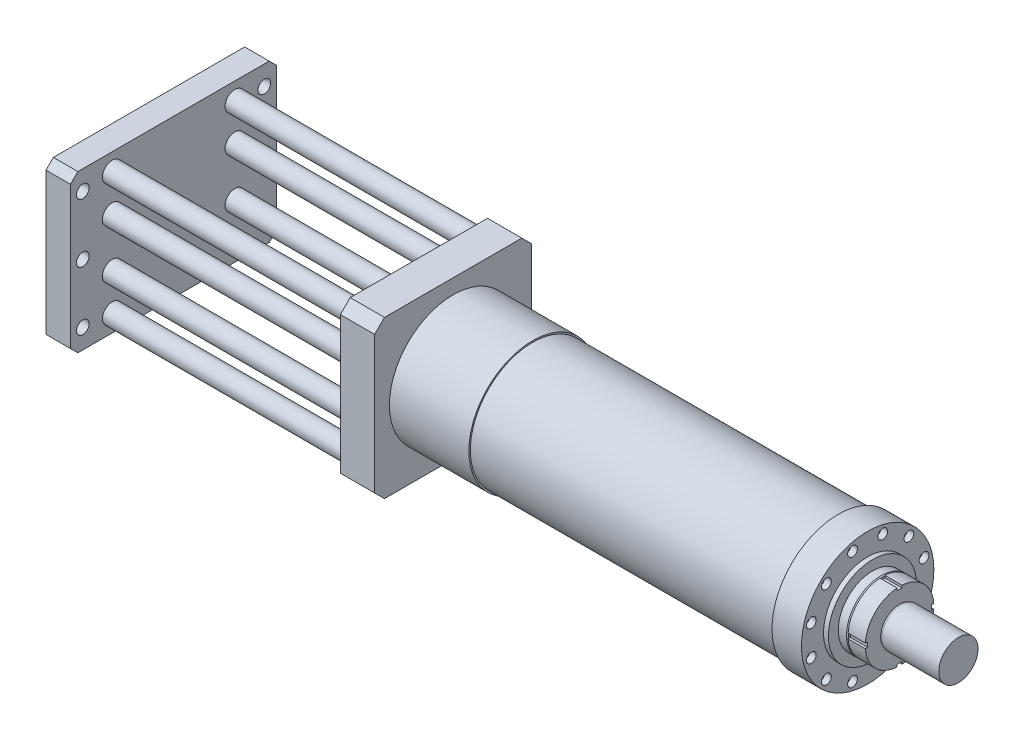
SolidWorks part; units mm, degrees
ref_plane "前视基准面" through (0, 0, 0) normal (0, 0, 1) x (1, 0, 0)
ref_plane "上视基准面" through (0, 0, 0) normal (0, 1, 0) x (1, 0, 0)
ref_plane "右视基准面" through (0, 0, 0) normal (1, 0, 0) x (0, 0, -1)
sketch "草图1" plane through (0, 0, 0) normal (1, 0, 0) x (0, 0, -1)
  circle A0 centre (0, 0) radius 127
  circle A1 centre (0, 0) radius 110
  dimension "D1" = 254
  dimension "D2" = 220
extrude "凸台-拉伸1" add sketch "草图1" along normal blind 623
sketch "草图2" plane through (623, 0, 0) normal (1, 0, 0) x (0, 0, -1)
  line L0 (0, 0) -> (30.7995, 114.9452) construction
  line L2 (0, 0) -> (0, 98.0667) construction
  circle A0 centre (0, 0) radius 135
  circle A1 centre (30.7995, 114.9452) radius 6.5
  circle A2 centre (84.1457, 84.1457) radius 6.5
  circle A3 centre (114.9452, 30.7995) radius 6.5
  circle A4 centre (114.9452, -30.7995) radius 6.5
  circle A5 centre (84.1457, -84.1457) radius 6.5
  circle A6 centre (30.7995, -114.9452) radius 6.5
  circle A7 centre (-30.7995, -114.9452) radius 6.5
  circle A8 centre (-84.1457, -84.1457) radius 6.5
  circle A9 centre (-114.9452, -30.7995) radius 6.5
  circle A10 centre (-114.9452, 30.7995) radius 6.5
  circle A11 centre (-84.1457, 84.1457) radius 6.5
  circle A12 centre (-30.7995, 114.9452) radius 6.5
  point P0 (0, 0)
  point P32 (0, 0)
  dimension "D1" = 270
  dimension "D4" = 12
  dimension "D2" = 119
  dimension "D3" = 15
extrude "凸台-拉伸2" add sketch "草图2" along normal blind 60 separate body
sketch "草图3" plane through (683, 0, 0) normal (1, 0, 0) x (0, 0, -1)
  circle A0 centre (0, 0) radius 90
  dimension "D1" = 180
extrude "凸台-拉伸3" add sketch "草图3" along normal blind 10
sketch "草图5" plane through (693, 0, 0) normal (1, 0, 0) x (0, 0, -1)
  circle A0 centre (0, 0) radius 70
  dimension "D1" = 140
extrude "凸台-拉伸4" add sketch "草图5" along normal blind 20
chamfer "倒角1" distance 3 angle 20 1 edges at (713, 0, -70)
sketch "草图7" plane through (713, 0, 0) normal (1, 0, 0) x (0, 0, -1)
  circle A0 centre (0, 0) radius 70
  dimension "D1" = 140
extrude "凸台-拉伸5" add sketch "草图7" along normal blind 35
sketch "草图8" plane through (748, 0, 0) normal (1, 0, 0) x (0, 0, -1)
  circle A0 centre (0, 0) radius 38.5
  dimension "D1" = 77
extrude "凸台-拉伸6" add sketch "草图8" along normal blind 4
sketch "草图9" plane through (752, 0, 0) normal (1, 0, 0) x (0, 0, -1)
  circle A0 centre (0, 0) radius 40
  dimension "D1" = 80
extrude "凸台-拉伸7" add sketch "草图9" along normal blind 116
sketch "草图10" plane through (748, 0, 0) normal (1, 0, 0) x (0, 0, -1)
  line L0 (-5, -77.2193) -> (-5, -65)
  line L1 (5, -77.2193) -> (5, -65)
  line L2 (-76.4659, 5) -> (-65, 5)
  line L3 (98.9652, -5) -> (65, -5)
  line L4 (-65, 5) -> (-65, -5)
  line L5 (65, 5) -> (65, -5)
  line L6 (-5, 65) -> (5, 65)
  line L7 (-5, -65) -> (5, -65)
  line L8 (-76.4659, 5) -> (-79.4605, -5)
  line L9 (98.9652, 5) -> (98.9652, -5)
  line L10 (-5, 100.6875) -> (5, 100.6875)
  line L11 (-5, -77.2193) -> (5, -77.2193)
  line L12 (5, 65) -> (5, 100.6875)
  line L13 (-5, 65) -> (-5, 100.6875)
  line L15 (-65, -5) -> (-79.4605, -5)
  line L19 (65, 5) -> (98.9652, 5)
  dimension "D1" = 5
  dimension "D2" = 5
  dimension "D3" = 5
  dimension "D4" = 5
  dimension "D5" = 65
  dimension "D6" = 65
  dimension "D7" = 65
  dimension "D8" = 65
extrude "切除-拉伸2" cut sketch "草图10" against normal blind 35 contours L10 L12 L6 L13 | L19 L9 L3 L5 | L0 L7 L1 L11 | L8 L15 L4 L2
sketch "草图11" plane through (0, 0, 0) normal (-1, 0, 0) x (0, 0, 1)
  circle A0 centre (0, 0) radius 130
  dimension "D1" = 260
extrude "凸台-拉伸8" add sketch "草图11" along normal blind 162 separate body
sketch "草图15" plane through (-162, 0, 0) normal (-1, 0, 0) x (0, 0, 1)
  line L5 (-160, 160) -> (160, 160)
  line L6 (-160, 160) -> (-160, -160)
  line L7 (-160, -160) -> (160, -160)
  line L8 (160, 160) -> (160, -160)
  line L9 (-160, 160) -> (160, -160) construction
  line L10 (-160, -160) -> (160, 160) construction
  point P0 (0, 0)
  dimension "D1" = 320
  dimension "D2" = 320
extrude "凸台-拉伸10" add sketch "草图15" along normal blind 70 separate body
sketch "草图16" plane through (-232, 0, 0) normal (-1, 0, 0) x (0, 0, 1)
  circle A0 centre (0, 0) radius 80
  dimension "D1" = 160
extrude "切除-拉伸4" cut sketch "草图16" against normal blind 26
sketch "草图17" plane through (-206, 0, 0) normal (-1, 0, 0) x (0, 0, 1)
  circle A0 centre (0, 0) radius 81.5
  dimension "D1" = 163
extrude "切除-拉伸5" cut sketch "草图17" against normal blind 38
sketch "草图18" plane through (-232, 0, 0) normal (-1, 0, 0) x (0, 0, 1)
  line L0 (0, 0) -> (0, 70.3712) construction
  line L1 (-210, 160) -> (210, 160)
  line L2 (-210, 160) -> (-210, -160)
  line L3 (-210, -160) -> (210, -160)
  line L4 (210, 160) -> (210, -160)
  line L5 (-210, 160) -> (210, -160) construction
  line L6 (-210, -160) -> (210, 160) construction
  circle A0 centre (-185, 120) radius 13
  circle A1 centre (-185, 0) radius 13
  circle A2 centre (-185, -120) radius 13
  circle A3 centre (185, -120) radius 13
  circle A4 centre (185, 0) radius 13
  circle A5 centre (185, 120) radius 13
  point P0 (0, 0)
  dimension "D6" = 26
  dimension "D7" = 26
  dimension "D8" = 26
  dimension "D1" = 420
  dimension "D2" = 320
  dimension "D3" = 240
  dimension "D4" = 120
  dimension "D5" = 40
  dimension "D9" = 25
extrude "凸台-拉伸11" add sketch "草图18" along normal blind 50 from offset 500 separate body
sketch "草图19" plane through (-232, 0, 0) normal (-1, 0, 0) x (0, 0, 1)
  line L0 (0, 0) -> (0, 53.8133) construction
  circle A0 centre (125, 125) radius 20
  circle A1 centre (125, -125) radius 20
  circle A2 centre (-125, -125) radius 20
  circle A3 centre (-125, 125) radius 20
  circle A4 centre (-125, 50) radius 20
  circle A5 centre (-125, -50) radius 20
  circle A6 centre (125, 50) radius 20
  circle A7 centre (125, -50) radius 20
  dimension "D5" = 40
  dimension "D6" = 40
  dimension "D11" = 40
  dimension "D12" = 40
  dimension "D13" = 40
  dimension "D14" = 40
  dimension "D1" = 125
  dimension "D2" = 125
  dimension "D3" = 125
  dimension "D4" = 125
  dimension "D7" = 75
  dimension "D8" = 75
  dimension "D9" = 75
  dimension "D10" = 75
extrude "凸台-拉伸12" add sketch "草图19" along normal blind 500
hole_wizard "孔1" positions "草图21" profile "草图22" legacy
sketch "草图21" plane through (683, 0, 0) normal (1, 0, 0) x (0, 0, -1)
  point P0 (-84.1457, 84.1457)
  point P3 (-30.7995, 114.9452)
  point P6 (30.7995, 114.9452)
  point P9 (84.1457, 84.1457)
  point P12 (114.9452, 30.7995)
  point P15 (114.9452, -30.7995)
  point P18 (84.1457, -84.1457)
  point P21 (30.7995, -114.9452)
  point P24 (-30.7995, -114.9452)
  point P27 (-84.1457, -84.1457)
  point P30 (-114.9452, -30.7995)
  point P33 (-114.9452, 30.7995)
sketch "草图22" plane through (683, 84.1457, 84.1457) normal (0, 1, 0) x (0, 0, -1)
  line L0 (0, 0) -> (0, 13)
  line L1 (0, 13) -> (10, 13)
  line L2 (10, 13) -> (10, 0)
  line L3 (10, 0) -> (0, 0)
  line L4 (0, 110) -> (0, -10) construction
  dimension "直径" = 20
  dimension "深度" = 13
chamfer "倒角2" distance 20 angle 45 4 edges at (-197, 160, -160) (-197, -160, -160) (-197, -160, 160) (-197, 160, 160)
chamfer "倒角3" distance 15 angle 45 4 edges at (-757, -160, -210) (-757, 160, -210) (-757, -160, 210) (-757, 160, 210)
